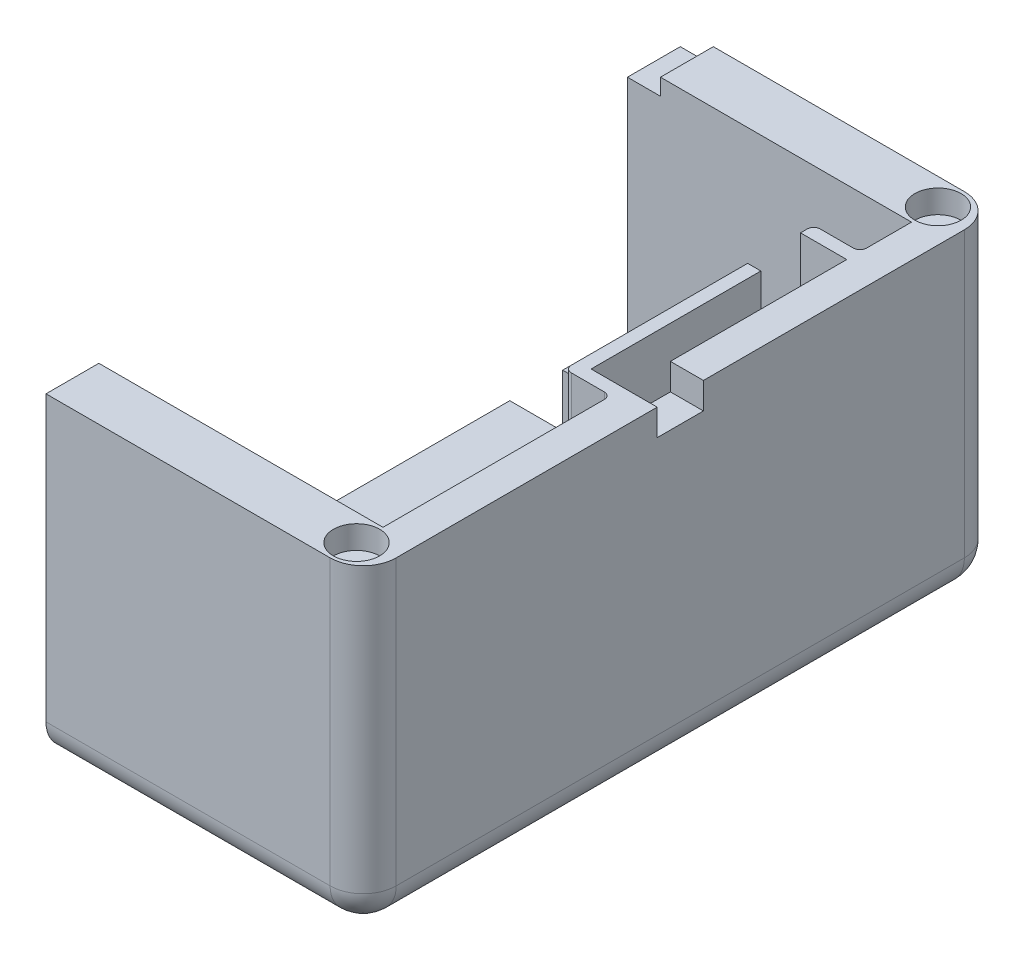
SolidWorks part; units mm, degrees
ref_plane "Piano frontale" through (0, 0, 0) normal (0, 0, 1) x (1, 0, 0)
ref_plane "Piano superiore" through (0, 0, 0) normal (0, 1, 0) x (1, 0, 0)
ref_plane "Piano destro" through (0, 0, 0) normal (1, 0, 0) x (0, 0, -1)
sketch "Sketch1" plane through (0, 0, 0) normal (0, 0, 1) x (1, 0, 0)
  line L1 (-22.553, -8.75) -> (25.447, -8.75)
  line L2 (-22.553, -8.75) -> (-22.553, 39.25)
  line L3 (-22.553, 39.25) -> (25.447, 39.25)
  line L4 (25.447, -8.75) -> (25.447, 39.25)
  dimension "D1" = 48
  dimension "D2" = 48
extrude "Boss-Extrude1" add sketch "Sketch1" along normal blind 8
sketch "Sketch2" plane through (0, 0, 8) normal (0, 0, 1) x (1, 0, 0)
  line L0 (-22.553, -8.75) -> (25.447, -8.75) construction
  line L1 (-22.553, -8.75) -> (25.447, -8.75)
  line L2 (-22.553, -8.75) -> (-22.553, -3.75)
  line L3 (-22.553, -3.75) -> (20.447, -3.75)
  line L4 (25.447, -8.75) -> (25.447, -3.75)
  line L5 (-22.553, 39.25) -> (-22.553, -8.75) construction
  line L6 (25.447, -8.75) -> (25.447, 39.25) construction
  line L7 (25.447, 39.25) -> (25.447, -3.75)
  line L9 (20.447, -3.75) -> (20.447, 39.25)
  line L10 (25.447, 39.25) -> (-22.553, 39.25) construction
  line L11 (20.447, 39.25) -> (25.447, 39.25)
  dimension "D1" = 5
  dimension "D2" = 5
extrude "Boss-Extrude2" add sketch "Sketch2" along normal blind 80
sketch "Sketch3" plane through (0, 0, 88) normal (0, 0, 1) x (1, 0, 0)
  line L0 (25.447, 39.25) -> (20.447, 39.25) construction
  line L1 (-22.553, -8.75) -> (25.447, -8.75)
  line L2 (-22.553, -8.75) -> (-22.553, 39.25)
  line L3 (-22.553, 39.25) -> (25.447, 39.25)
  line L4 (25.447, -8.75) -> (25.447, 39.25)
extrude "Boss-Extrude3" add sketch "Sketch3" along normal blind 8
fillet "Fillet1" radius 5 5 edges at (1.447, -8.75, 96) (25.447, -8.75, 48) (1.447, -8.75, 0) (25.447, 15.25, 96) (25.447, 15.25, 0)
sketch "Sketch4" plane through (25.447, 0, 0) normal (1, 0, 0) x (0, 0, -1)
  line L0 (-91, 39.25) -> (-5, 39.25) construction
  line L2 (-44.5, 39.25) -> (-51.5, 39.25)
  line L3 (-44.5, 39.25) -> (-44.5, 35.25)
  line L4 (-44.5, 35.25) -> (-51.5, 35.25)
  line L5 (-51.5, 39.25) -> (-51.5, 35.25)
  point P0 (-48, 39.25)
  dimension "D1" = 3.5
  dimension "D2" = 7
  dimension "D3" = 4
extrude "Cut-Extrude1" cut sketch "Sketch4" against normal blind 10
sketch "Sketch5" plane through (20.447, 0, 0) normal (-1, 0, 0) x (0, 0, 1)
  line L0 (51.5, 35.25) -> (44.5, 35.25) construction
  line L1 (48, 35.25) -> (48, 43.0761) construction
  line L2 (48, 43.0761) -> (48, 66.4757) construction
  line L3 (51.5, 39.25) -> (32.7393, 39.25) construction
  line L4 (88, 39.25) -> (51.5, 39.25) construction
  line L5 (44.5, 39.25) -> (8, 39.25) construction
  line L6 (51.5, 39.25) -> (51.5, 35.25) construction
  line L7 (51.5, 39.25) -> (17.8063, 39.25)
  line L8 (51.5, 39.25) -> (51.5, 30.25)
  line L9 (51.5, 30.25) -> (17.8063, 30.25)
  line L10 (17.8063, 39.25) -> (17.8063, 30.25)
  line L11 (53.5, 28.25) -> (15.8063, 28.25)
  line L12 (53.5, 28.25) -> (53.5, 39.25)
  line L13 (17.8063, 39.25) -> (15.8063, 39.25)
  line L14 (15.8063, 39.25) -> (15.8063, 28.25)
  line L15 (53.5, 41.25) -> (15.8063, 41.25) construction
  line L16 (53.5, 41.25) -> (53.5, 28.25) construction
  line L17 (15.8063, 41.25) -> (15.8063, 28.25) construction
  line L18 (51.5, 39.25) -> (53.5, 39.25)
  point P0 (48, 35.25)
  point P12 (48, 39.25)
  dimension "D1" = 9
  dimension "D2" = 0
  dimension "D3" = 2
extrude "Boss-Extrude4" add sketch "Sketch5" along normal blind 7 contours L14 L11 L12 L8 L9 L10 M6 M10 M11
sketch "Sketch6" plane through (0, 30.25, 0) normal (0, 1, 0) x (1, 0, 0)
  line L0 (13.447, -51.5) -> (20.447, -51.5) construction
  line L1 (13.447, -51.5) -> (15.447, -51.5)
  line L2 (13.447, -51.5) -> (13.447, -17.8063)
  line L3 (13.447, -17.8063) -> (15.447, -17.8063)
  line L4 (15.447, -51.5) -> (15.447, -17.8063)
  line L5 (13.447, -51.5) -> (13.447, -17.8063) construction
  line L6 (13.447, -17.8063) -> (20.447, -17.8063) construction
  dimension "D1" = 2
extrude "Boss-Extrude5" add sketch "Sketch6" along normal blind 9
sketch "Sketch8" plane through (13.447, 0, 0) normal (-1, 0, 0) x (0, 0, 1)
  line L0 (53.5, 39.25) -> (15.8063, 39.25) construction
  line L1 (17.8063, 39.25) -> (25.8063, 39.25)
  line L2 (53.5, 28.25) -> (15.8063, 28.25) construction
  line L3 (25.8063, 39.25) -> (17.8063, 39.25)
  line L4 (25.8063, 39.25) -> (25.8063, 30.25)
  line L7 (25.8063, 30.25) -> (17.8063, 30.25)
  line L8 (17.8063, 39.25) -> (17.8063, 30.25)
  dimension "D1" = 2
extrude "Cut-Extrude2" cut sketch "Sketch8" against normal blind 5 contours L8 L7 L4 M5
ref_plane "Plane3" through (8.3485, 8.3485, 0) normal (0.7071, 0.7071, 0) x (0.7071, -0.7071, 0)
mirror "Mirror1" about plane through (8.3485, 8.3485, 0) normal (0.7071, 0.7071, 0) of "Cut-Extrude2", "Boss-Extrude5", "Boss-Extrude4", "Cut-Extrude1"
sketch "Sketch12" plane through (0, 39.25, 0) normal (0, 1, 0) x (1, 0, 0)
  line L0 (20.447, -88) -> (20.447, -97.7461) construction
  circle A0 centre (20.447, -92) radius 3.5
  dimension "D1" = 7
  dimension "D3" = 4
  dimension "D2" = 0
extrude "Cut-Extrude9" cut sketch "Sketch12" against normal blind 3.5
mirror "Mirror2" about plane through (8.3485, 8.3485, 0) normal (0.7071, 0.7071, 0) of "Cut-Extrude9"
ref_plane "Plane5" through (0, 0, 48) normal (0, 0, 1) x (1, 0, 0)
mirror "Mirror3" about plane through (0, 0, 48) normal (0, 0, 1) of "Mirror2", "Cut-Extrude9"
sketch "Sketch13" plane through (0, 0, 0) normal (0, 0, -1) x (-1, 0, 0)
  line L1 (17.553, 39.25) -> (22.553, 39.25)
  line L2 (17.553, 39.25) -> (17.553, 36.75)
  line L3 (17.553, 36.75) -> (22.553, 36.75)
  line L4 (22.553, 39.25) -> (22.553, 36.75)
  line L6 (-20.447, 39.25) -> (22.553, 39.25) construction
extrude "Cut-Extrude10" cut sketch "Sketch13" against normal blind 10
sketch "Sketch15" plane through (0, 0, 88) normal (0, 0, -1) x (-1, 0, 0)
  circle A0 centre (-4.527, 22.91) radius 1.59
extrude "Boss-Extrude6" add sketch "Sketch15" along normal mid plane 10
sketch "Sketch16" plane through (0, 0, 83) normal (0, 0, -1) x (-1, 0, 0)
  circle A0 centre (-4.527, 22.91) radius 5
  dimension "D1" = 10
sketch "Sketch19" plane through (0, 0, 83) normal (0, 0, -1) x (-1, 0, 0)
  circle A0 centre (-4.527, 22.91) radius 2.5
  circle A1 centre (-4.527, 22.91) radius 1.59 construction
  dimension "D1" = 5
  dimension "D2" = 0
extrude "Boss-Extrude8" add sketch "Sketch19" against normal up to next
sketch "Sketch20" plane through (0, 0, 83) normal (0, 0, -1) x (-1, 0, 0)
  circle A0 centre (-4.527, 22.91) radius 1.75
  circle A1 centre (-4.527, 22.91) radius 2.5 construction
  dimension "D1" = 3.5
  dimension "D2" = 0
extrude "Cut-Extrude13" cut sketch "Sketch20" against normal blind 3
extrude "Boss-Extrude7" add sketch "Sketch16" along normal blind 2 and the other way blind 5
sketch "Sketch18" plane through (0, 0, 81) normal (0, 0, -1) x (-1, 0, 0)
  circle A0 centre (-4.527, 22.91) radius 1.75
  circle A1 centre (-4.527, 22.91) radius 5 construction
  dimension "D1" = 3.5
  dimension "D2" = 0
extrude "Cut-Extrude12" cut sketch "Sketch18" against normal blind 3
fillet "Fillet2" radius 1 8 edges at (-17.053, -3.75, 15.8063) (-11.553, -0.25, 15.8063) (-17.053, 3.25, 15.8063) (-11.553, -0.25, 53.5) (-11.553, 3.25, 34.6531) (-17.053, 3.25, 53.5) (-11.553, -3.75, 34.6531) (-17.053, -3.75, 53.5)
fillet "Fillet3" radius 1 7 edges at (20.447, 33.75, 15.8063) (13.447, 33.75, 15.8063) (16.947, 28.25, 15.8063) (20.447, 28.25, 34.6531) (13.447, 28.25, 34.6531) (20.447, 33.75, 53.5) (13.447, 33.75, 53.5)
equation "\"ir_lenght\"= 5"
equation "\"ir_width\"= 10"
equation "\"D2@Sketch13\"= \"ir_lenght\"/ 2"
equation "\"D3@Sketch13\"=\"ir_width\"/2"
